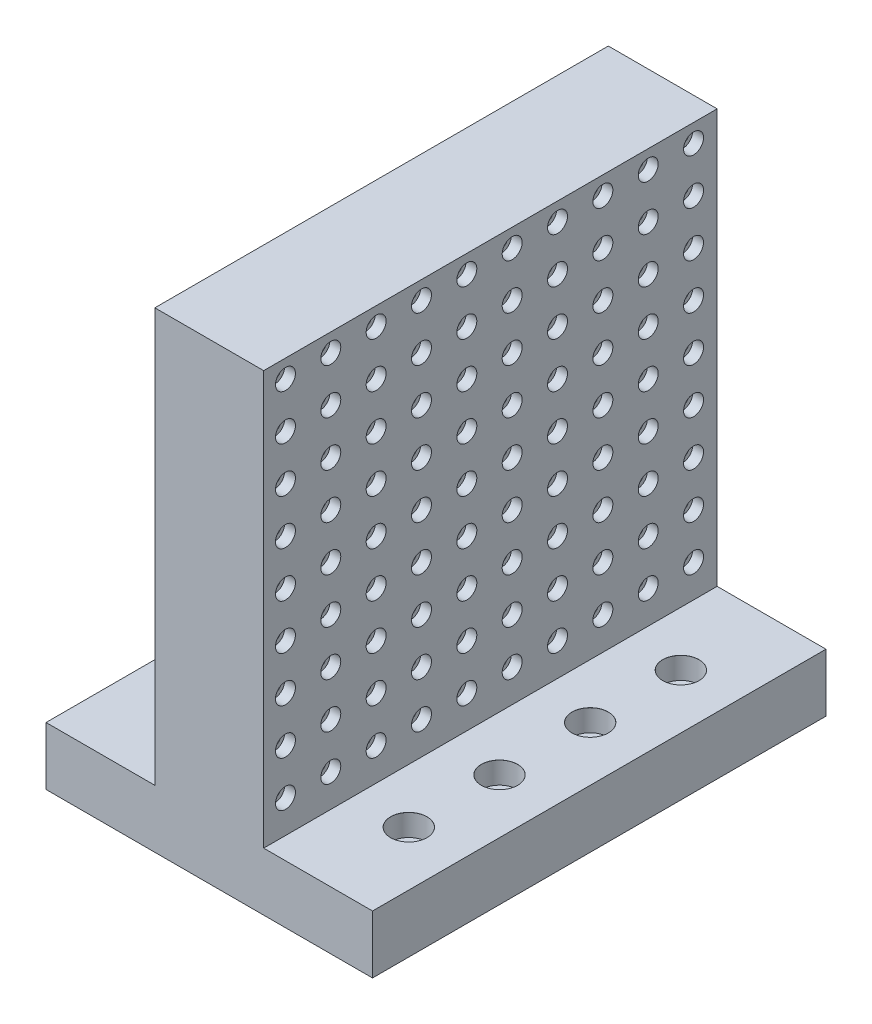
SolidWorks part; units mm, degrees
ref_plane "Face" through (0, 0, 0) normal (0, 0, 1) x (1, 0, 0)
ref_plane "Dessus" through (0, 0, 0) normal (0, 1, 0) x (1, 0, 0)
ref_plane "Droite" through (0, 0, 0) normal (1, 0, 0) x (0, 0, -1)
sketch "Esquisse1" plane through (0, 0, 0) normal (0, 0, 1) x (1, 0, 0)
  line L0 (-17.3388, 0) -> (162.6612, 0)
  line L1 (162.6612, 0) -> (162.6612, 32)
  line L2 (162.6612, 32) -> (102.6612, 32)
  line L3 (102.6612, 32) -> (102.6612, 260)
  line L4 (102.6612, 260) -> (42.6612, 260)
  line L5 (42.6612, 260) -> (42.6612, 32)
  line L6 (42.6612, 32) -> (-17.3388, 32)
  line L7 (-17.3388, 32) -> (-17.3388, 0)
  dimension "D1" = 180
  dimension "D2" = 32
  dimension "D3" = 260
  dimension "D4" = 32
  dimension "D5" = 60
  dimension "D6" = 60
extrude "Boss.-Extru.1" add sketch "Esquisse1" against normal blind 250
hole_wizard "Chambrage pour vis à tête hexagonale M61" positions "Esquisse3" profile "Esquisse2" counterbore size "M6" standard "ISO"
sketch "Esquisse3" plane through (102.6612, 0, 0) normal (1, 0, 0) x (0, 0, -1)
  line L0 (0, 32) -> (0, 260) construction
  line L1 (250, 260) -> (0, 260) construction
  point P0 (12, 250)
  dimension "D1" = 12
  dimension "D2" = 10
sketch "Esquisse2" plane through (102.6612, 250, -12) normal (0, 1, 0) x (0, 0, -1)
  line L0 (0, 0) -> (0, 120)
  line L1 (0, 120) -> (3.3, 120)
  line L3 (3.3, 120) -> (3.3, 6)
  line L4 (3.3, 6) -> (5.5, 6)
  line L5 (5.5, 6) -> (5.5, 0)
  line L7 (5.5, 0) -> (0, 0)
  line L11 (0, -6.35) -> (0, 107.95) construction
  dimension "Diamètre du perçage jusqu'au prochain" = 6.6
  dimension "Profondeur du perçage jusqu'au prochain" = 120
  dimension "Diamètre du chambrage" = 11
  dimension "Profondeur du chambrage" = 6
sketch "Esquisse8" plane through (42.6612, 0, 0) normal (-1, 0, 0) x (0, 0, 1)
  circle A0 centre (-12, 250) radius 5.5
  dimension "D1" = 11
extrude "Enlèv. mat.-Extru.1" cut sketch "Esquisse8" against normal blind 6
pattern_linear "Répétition linéaire1" count 10 spacing 25 along (0, 0, -1) count 9 spacing 25 along (0, -1, 0) of "Enlèv. mat.-Extru.1", "Chambrage pour vis à tête hexagonale M61"
hole_wizard "Chambrage pour vis à tête hexagonale M121" positions "Esquisse10" profile "Esquisse9" counterbore size "M12" standard "ISO"
sketch "Esquisse10" plane through (0, 32, 0) normal (0, 1, 0) x (-1, 0, 0)
  line L0 (-162.6612, 0) -> (-102.6612, 0) construction
  line L2 (-42.6612, 0) -> (17.3388, 0) construction
  line L3 (-42.6612, -250) -> (-42.6612, 0) construction
  line L4 (-102.6612, -250) -> (-102.6612, 0) construction
  point P0 (-132.6612, -50)
  point P1 (-132.6612, -100)
  point P3 (-132.6612, -150)
  point P5 (-132.6612, -200)
  point P7 (-12.6612, -200)
  point P9 (-12.6612, -150)
  point P11 (-12.6612, -100)
  point P13 (-12.6612, -50)
  point P20 (-12.6612, 0)
  dimension "D1" = 50
  dimension "D2" = 50
  dimension "D3" = 50
  dimension "D4" = 50
  dimension "D6" = 50
  dimension "D7" = 50
  dimension "D8" = 50
  dimension "D9" = 50
  dimension "D10" = 30
  dimension "D11" = 30
sketch "Esquisse9" plane through (132.6612, 32, -50) normal (1, 0, 0) x (0, 0, 1)
  line L0 (0, 0) -> (0, 32)
  line L1 (6.75, 31.475) -> (7.275, 32)
  line L2 (10, 12) -> (6.75, 12)
  line L3 (6.75, 12) -> (6.75, 31.475)
  line L5 (10, 12) -> (10, 0.025)
  line L6 (10, 0.025) -> (10.025, 0)
  line L7 (10.025, 0) -> (0, 0)
  line L8 (-10, 0.025) -> (-10.025, 0) construction
  line L11 (0, -6.35) -> (0, 107.95) construction
  line L12 (7.275, 32) -> (0, 32)
  line L13 (-6.75, 31.475) -> (-7.275, 32) construction
  dimension "Diamètre du perçage jusqu'au prochain" = 13.5
  dimension "Profondeur du perçage jusqu'au prochain" = 32
  dimension "Diamètre du chambrage" = 20
  dimension "Profondeur du chambrage" = 12
  dimension "Diamètre du fraisage entrant" = 20.05
  dimension "Angle du fraisage entrant" = 90
  dimension "Diamètre du fraisage débouchant" = 14.55
  dimension "Angle du fraisage débouchant" = 90
